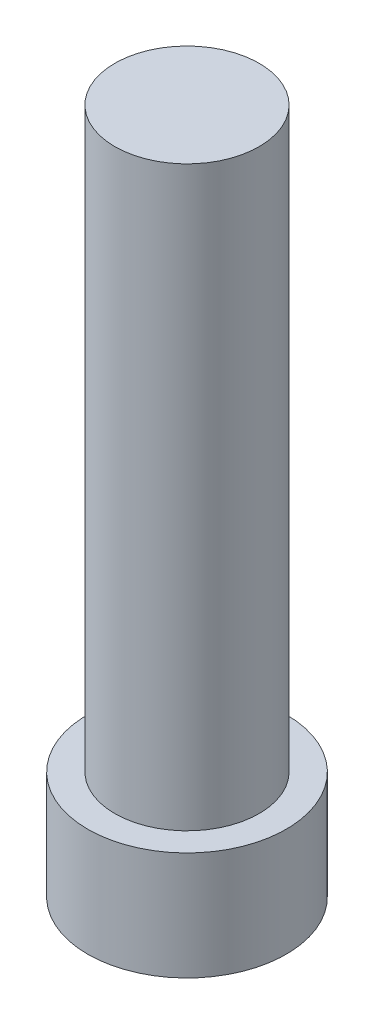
SolidWorks part; units mm, degrees
ref_plane "前视基准面" through (0, 0, 0) normal (0, 0, 1) x (1, 0, 0)
ref_plane "上视基准面" through (0, 0, 0) normal (0, 1, 0) x (1, 0, 0)
ref_plane "右视基准面" through (0, 0, 0) normal (1, 0, 0) x (0, 0, -1)
other "Configuration Table"
sketch "草图1" plane through (0, 0, 0) normal (0, 1, 0) x (1, 0, 0)
  circle A0 centre (0, 0) radius 2.75
  dimension "D1" = 5.5
extrude "凸台-拉伸1" add sketch "草图1" along normal blind 3
sketch "草图2" plane through (0, 3, 0) normal (0, 1, 0) x (1, 0, 0)
  circle A0 centre (0, 0) radius 2
  dimension "D1" = 4
extrude "凸台-拉伸2" add sketch "草图2" along normal blind 16
sketch "草图3" plane through (0, 0, 0) normal (0, -1, 0) x (1, 0, 0)
  line L1 (1.0917, -0.9442) -> (1.3636, 0.4733)
  line L2 (1.3636, 0.4733) -> (0.2719, 1.4175)
  line L3 (0.2719, 1.4175) -> (-1.0917, 0.9442)
  line L4 (-1.0917, 0.9442) -> (-1.3636, -0.4733)
  line L5 (-1.3636, -0.4733) -> (-0.2719, -1.4175)
  line L6 (-0.2719, -1.4175) -> (1.0917, -0.9442)
  circle A0 centre (0, 0) radius 1.25 construction
  dimension "D1" = 2.5
extrude "切除-拉伸1" cut sketch "草图3" against normal blind 1.5
